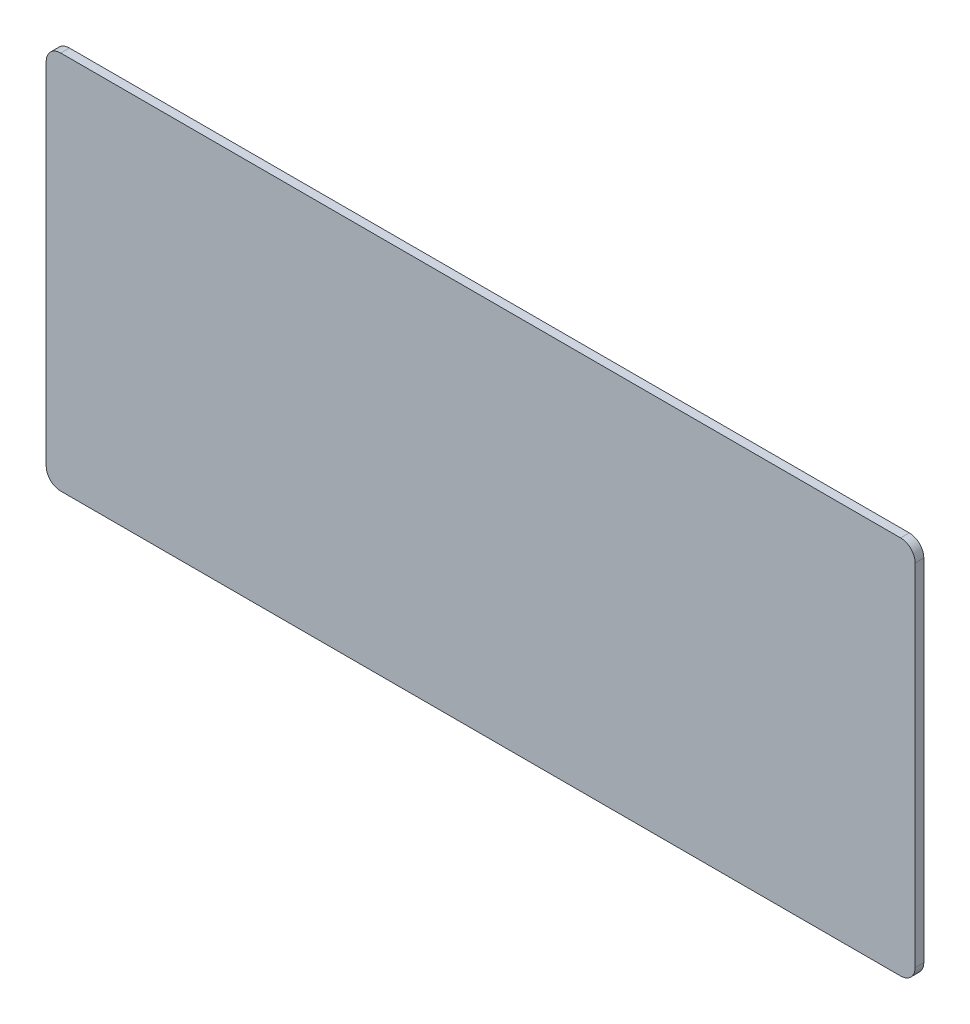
SolidWorks part; units mm, degrees
ref_plane "Plano frontal" through (0, 0, 0) normal (0, 0, 1) x (1, 0, 0)
ref_plane "Plano superior" through (0, 0, 0) normal (0, 1, 0) x (1, 0, 0)
ref_plane "Plano direito" through (0, 0, 0) normal (1, 0, 0) x (0, 0, -1)
sketch "Esboço1" plane through (0, 0, 0) normal (0, 0, 1) x (1, 0, 0)
  line L1 (0, 0) -> (600, 0)
  line L2 (0, 0) -> (0, -250)
  line L3 (0, -250) -> (600, -250)
  line L4 (600, 0) -> (600, -250)
  dimension "D1" = 600
  dimension "D2" = 250
extrude "Ressalto-extrusão1" add sketch "Esboço1" along normal blind 6
sketch "Esboço2" plane through (0, -250, 0) normal (0, -1, 0) x (1, 0, 0)
  line L1 (0, 6) -> (600, 6)
  line L2 (0, 6) -> (0, 0)
  line L3 (0, 0) -> (600, 0)
  line L4 (600, 6) -> (600, 0)
extrude "Ressalto-extrusão2" add sketch "Esboço2" along normal blind 12
sketch "Esboço3" plane through (600, 0, 0) normal (1, 0, 0) x (0, 0, -1)
  line L1 (-6, 0) -> (0, 0)
  line L2 (-6, 0) -> (-6, -262)
  line L3 (-6, -262) -> (0, -262)
  line L4 (0, 0) -> (0, -262)
fillet "Filete1" radius 10 4 edges at (0, -262, 3) (0, 0, 3) (600, -262, 3) (600, 0, 3)
